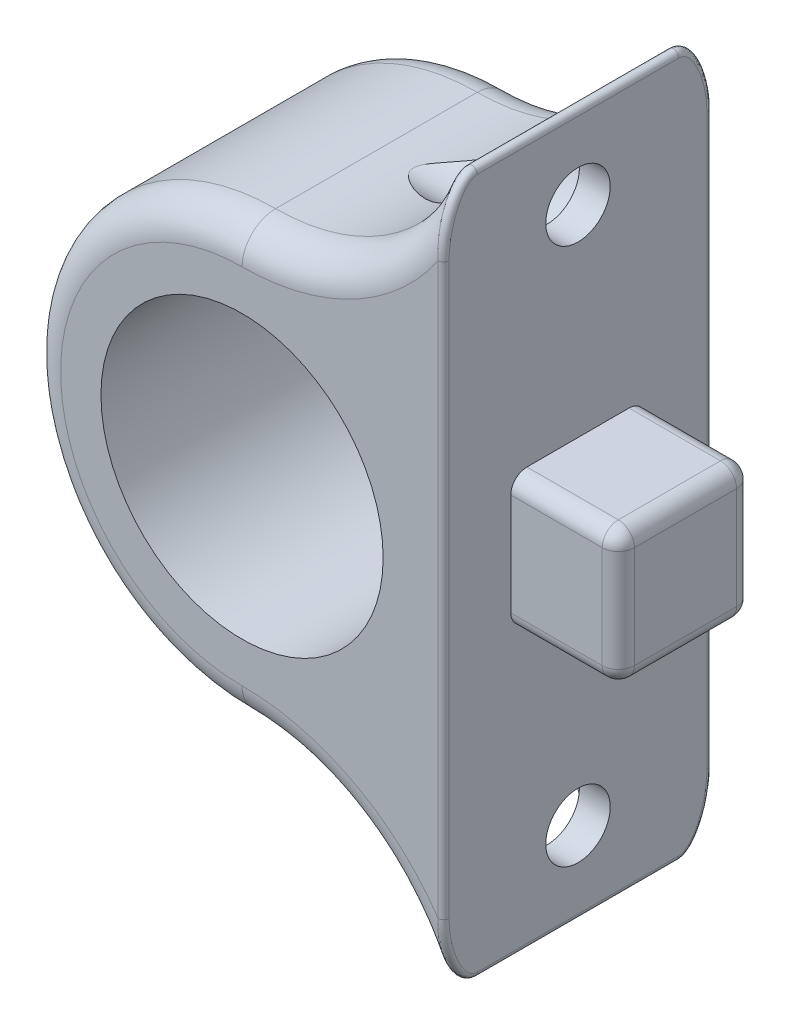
SolidWorks part; units mm, degrees
ref_plane "Front Plane" through (0, 0, 0) normal (0, 0, 1) x (1, 0, 0)
ref_plane "Top Plane" through (0, 0, 0) normal (0, 1, 0) x (1, 0, 0)
ref_plane "Right Plane" through (0, 0, 0) normal (1, 0, 0) x (0, 0, -1)
sketch "Sketch1" plane through (0, 0, 0) normal (0, 0, 1) x (1, 0, 0)
  line L0 (0, 18.2562) -> (0, -18.2562)
  circle A0 centre (-9.525, 0) radius 6.6675
  arc A1 (-9.525, 10.16) -> (-9.525, -10.16) centre (-9.525, 0) ccw
  arc A2 (-9.525, 10.16) -> (0, 18.2562) centre (-9.525, 19.8111) ccw
  arc A3 (-9.525, -10.16) -> (0, -18.2562) centre (-9.525, -19.8111) cw
  point P3 (0, 0)
  dimension "D1" = 13.335
  dimension "D3" = 10.16
  dimension "D4" = 36.5125
  dimension "D2" = 9.525
extrude "Boss-Extrude1" add sketch "Sketch1" along normal blind 12.7
fillet "Fillet1" radius 1.5875 6 edges at (-3.2745, 12.4575, 0) (-3.2745, -12.4575, 0) (-3.2745, 12.4575, 12.7) (-19.685, 0, 12.7) (-19.685, 0, 0) (-3.2745, -12.4575, 12.7)
sketch "Sketch2" plane through (0, 0, 0) normal (1, 0, 0) x (0, 0, -1)
  line L0 (-11.1125, 18.2562) -> (-1.5875, 18.2562) construction
  line L1 (-8.763, -3.175) -> (-3.937, -3.175)
  line L2 (-9.525, -2.413) -> (-9.525, 2.413)
  line L3 (-8.763, 3.175) -> (-3.937, 3.175)
  line L4 (-3.175, -2.413) -> (-3.175, 2.413)
  line L5 (-9.525, -3.175) -> (-3.175, 3.175) construction
  line L6 (-9.525, 3.175) -> (-3.175, -3.175) construction
  arc A0 (-3.937, -3.175) -> (-3.175, -2.413) centre (-3.937, -2.413) ccw
  arc A1 (-3.937, 3.175) -> (-3.175, 2.413) centre (-3.937, 2.413) cw
  arc A2 (-9.525, 2.413) -> (-8.763, 3.175) centre (-8.763, 2.413) cw
  arc A3 (-8.763, -3.175) -> (-9.525, -2.413) centre (-8.763, -2.413) cw
  point P0 (-6.35, 0)
  point P14 (-6.35, 18.2562)
  dimension "D3" = 0.762
  dimension "D1" = 6.35
  dimension "D2" = 6.35
extrude "Boss-Extrude2" add sketch "Sketch2" along normal blind 5.08
fillet "Fillet2" radius 0.762 8 edges at (5.08, 2.9518, 9.3018) (5.08, 3.175, 6.35) (5.08, 2.9518, 3.3982) (5.08, 0, 3.175) (5.08, -2.9518, 3.3982) (5.08, -3.175, 6.35) (5.08, -2.9518, 9.3018) (5.08, 0, 9.525)
sketch "Sketch3" plane through (0, 0, 0) normal (1, 0, 0) x (0, 0, -1)
  line L0 (-6.35, -12.7) -> (-6.35, 12.7) construction
  line L1 (-11.1125, 18.2562) -> (-1.5875, 18.2562) construction
  circle A0 centre (-6.35, -12.7) radius 1.524
  circle A1 centre (-6.35, 12.7) radius 1.524
  point P4 (-6.35, 0)
  point P8 (-6.35, 18.2562)
  dimension "D1" = 25.4
  dimension "D2" = 3.048
extrude "Cut-Extrude1" cut sketch "Sketch3" against normal up to next
ref_plane "Plane1" through (-16.1925, 0, 0) normal (1, 0, 0) x (0, 0, -1)
sketch "Sketch4" plane through (-16.1925, 0, 0) normal (1, 0, 0) x (0, 0, -1)
  circle A0 centre (-6.35, 12.7) radius 2.3813
  circle A1 centre (-6.35, -12.7) radius 2.3813
  dimension "D1" = 4.7625
extrude "Cut-Extrude2" cut sketch "Sketch4" along normal blind 14.732
fillet "Fillet3" radius 0.254 8 edges at (0, 18.1708, 11.3238) (0, 0, 12.7) (0, -17.8018, 11.6207) (0, -18.2562, 6.35) (0, -18.1708, 1.3762) (0, 0, 0) (0, 17.8018, 1.0793) (0, 18.2562, 6.35)
